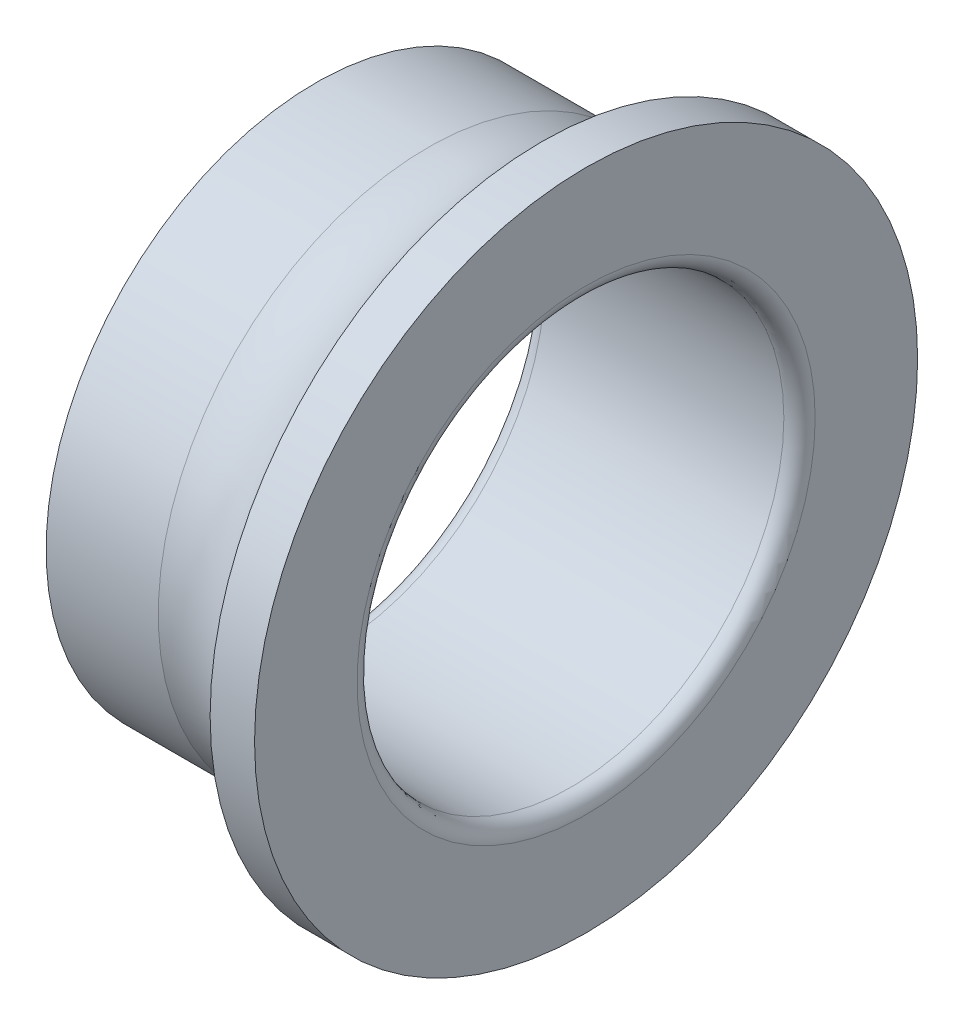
SolidWorks part; units mm, degrees
ref_plane "Alzado" through (0, 0, 0) normal (0, 0, 1) x (1, 0, 0)
ref_plane "Planta" through (0, 0, 0) normal (0, 1, 0) x (1, 0, 0)
ref_plane "Vista lateral" through (0, 0, 0) normal (1, 0, 0) x (0, 0, -1)
ref_plane "Plano1" through (0, 0, 0) normal (0, 0, 1) x (1, 0, 0)
sketch "Croquis1" plane through (0, 0, 0) normal (0, 0, 1) x (1, 0, 0)
  line L0 (1.1, 15) -> (17.9, 15)
  line L1 (19, 16.1) -> (19, 23.3)
  line L2 (19, 23.3) -> (15.8782, 23.3)
  line L3 (7.8815, 18.95) -> (0, 18.95)
  line L4 (0, 18.95) -> (0, 16.1)
  line L5 (19, 0) -> (0, 0) construction
  arc A0 (0, 16.1) -> (1.1, 15) centre (1.1, 16.1) ccw
  arc A1 (17.9, 15) -> (19, 16.1) centre (17.9, 16.1) ccw
  arc A2 (15.8782, 23.3) -> (7.8815, 18.95) centre (9.5, 25.5) cw
revolve "Revolución1" add sketch "Croquis1" angle 360 about L5
